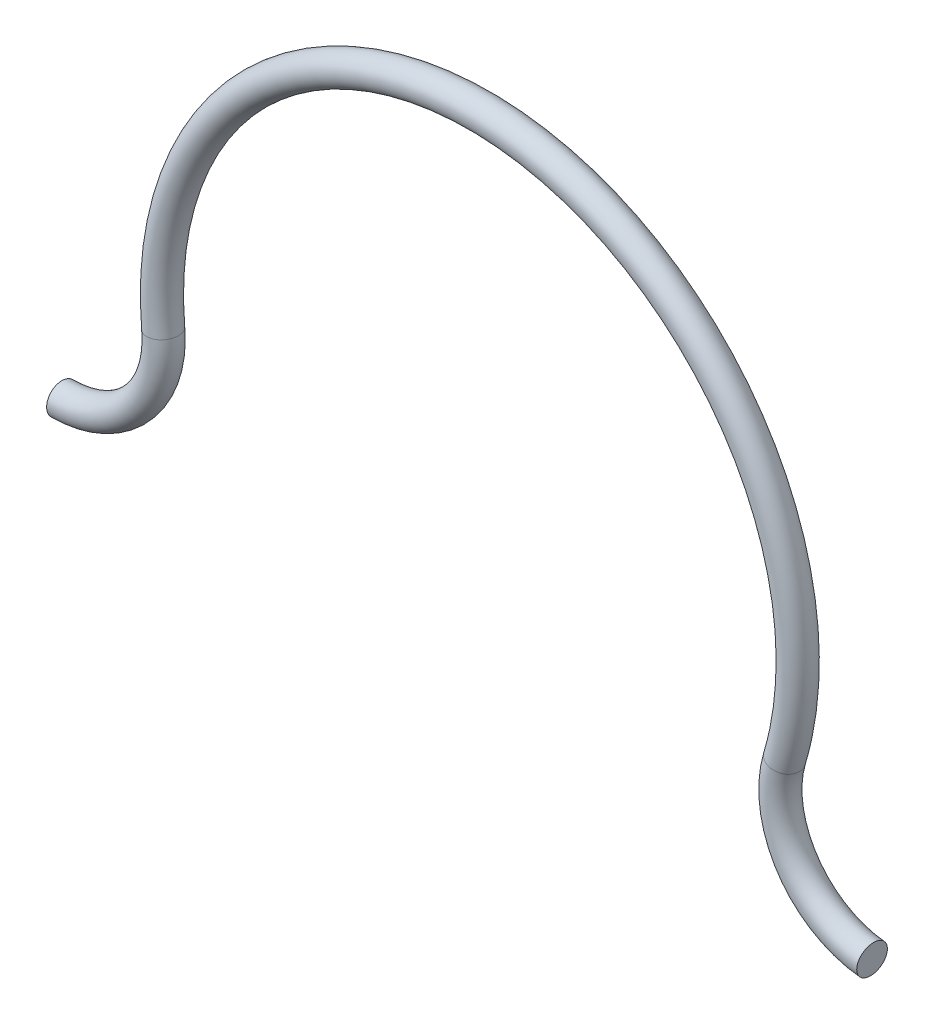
SolidWorks part; units mm, degrees
ref_plane "Ebene vorne" through (0, 0, 0) normal (0, 0, 1) x (1, 0, 0)
ref_plane "Ebene oben" through (0, 0, 0) normal (0, 1, 0) x (1, 0, 0)
ref_plane "Ebene rechts" through (0, 0, 0) normal (1, 0, 0) x (0, 0, -1)
sketch "Skizze1" plane through (0, 0, 0) normal (0, 0, 1) x (1, 0, 0)
  line L0 (0, 0) -> (0, -100) construction
  line L1 (0, -100) -> (796.0644, -179.2562) construction
  arc A0 (0, -100) -> (99.5834, 9.1186) centre (0, 0) ccw
  arc A1 (710.106, -51.2906) -> (796.0644, -179.2562) centre (805.9714, -79.7481) ccw
  arc A2 (710.106, -51.2906) -> (99.5834, 9.1186) centre (410.6517, 37.6022) ccw
  dimension "D1" = 100
  dimension "D2" = 1100
sketch "Skizze3" plane through (0, 0, 0) normal (1, 0, 0) x (0, 0, -1)
  circle A0 centre (0, -100) radius 15
  dimension "D1" = 30
sweep "Austragung1" add profiles "Skizze3" path "Skizze1"
equation "\"LÄNGE\"=0"
equation "\"BREITE\"=0"
equation "\"HÖHE\"=0"
equation "\"DURCHMESSER\"=0"
equation "\"Stückzahl\"= 1"
